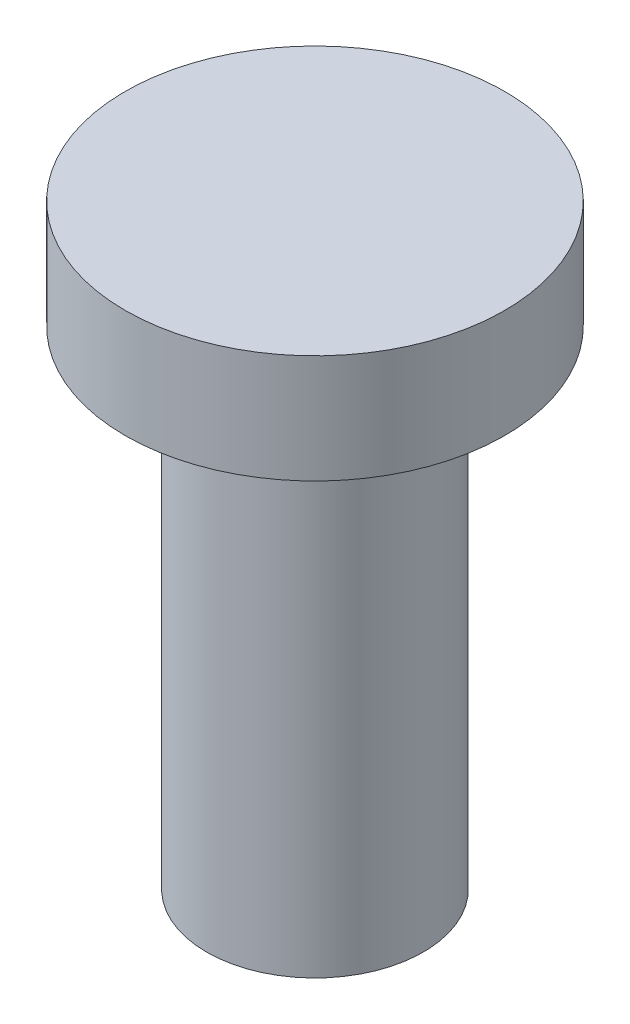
SolidWorks part; units mm, degrees
ref_plane "Płaszczyzna przednia" through (0, 0, 0) normal (0, 0, 1) x (1, 0, 0)
ref_plane "Płaszczyzna górna" through (0, 0, 0) normal (0, 1, 0) x (1, 0, 0)
ref_plane "Płaszczyzna prawa" through (0, 0, 0) normal (1, 0, 0) x (0, 0, -1)
sketch "Szkic1" plane through (0, 0, 0) normal (0, 0, 1) x (1, 0, 0)
  line L0 (0, 0) -> (-10, 0)
  line L1 (-10, 0) -> (-10, 45)
  line L2 (-10, 45) -> (-17.5, 45)
  line L3 (-17.5, 45) -> (-17.5, 55)
  line L4 (-17.5, 55) -> (0, 55)
  line L5 (0, 55) -> (0, 0)
  line L6 (0, 0) -> (0, -8.1326) construction
  dimension "D1" = 20
  dimension "D2" = 35
  dimension "D3" = 45
  dimension "D4" = 55
revolve "Obrót1" add sketch "Szkic1" angle 360 about L6
